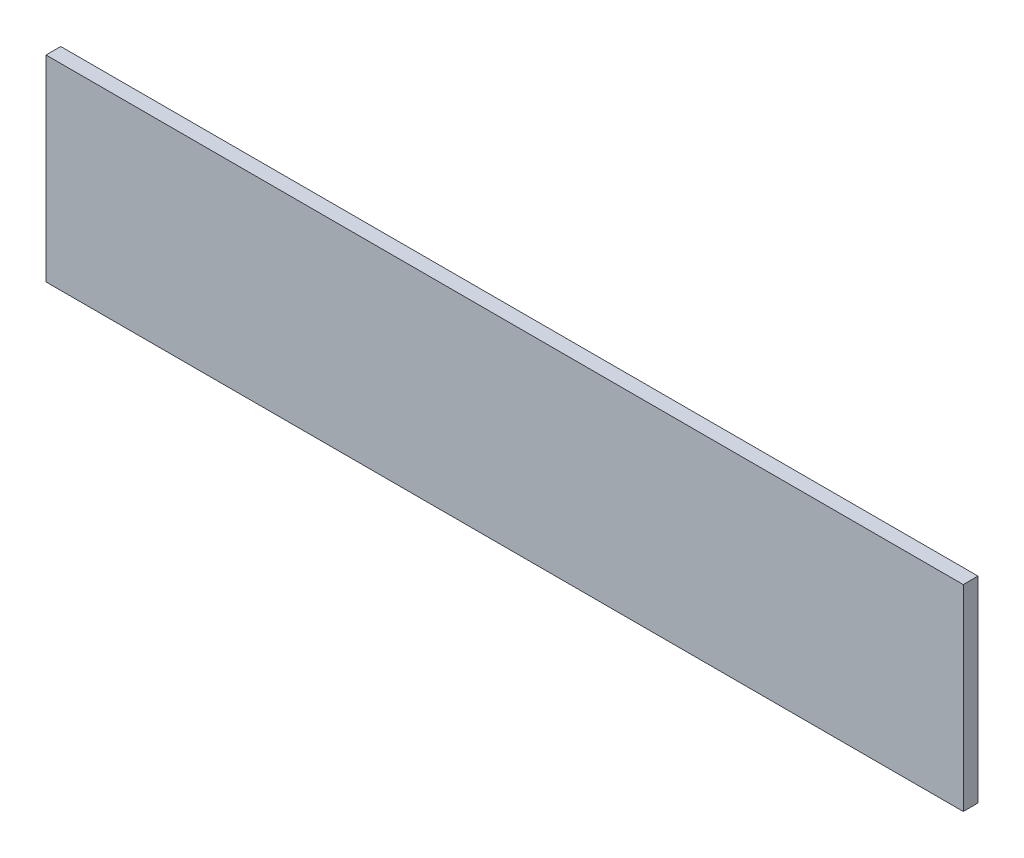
SolidWorks part; units mm, degrees
ref_plane "Front Plane" through (0, 0, 0) normal (0, 0, 1) x (1, 0, 0)
ref_plane "Top Plane" through (0, 0, 0) normal (0, 1, 0) x (1, 0, 0)
ref_plane "Right Plane" through (0, 0, 0) normal (1, 0, 0) x (0, 0, -1)
sketch "Sketch1" plane through (0, 0, 0) normal (0, 0, 1) x (1, 0, 0)
  line L1 (140, -30) -> (-140, -30)
  line L2 (140, -30) -> (140, 30)
  line L3 (140, 30) -> (-140, 30)
  line L4 (-140, -30) -> (-140, 30)
  line L5 (140, -30) -> (-140, 30) construction
  line L6 (140, 30) -> (-140, -30) construction
  point P0 (0, 0)
  dimension "D1" = 280
  dimension "D2" = 60
extrude "Boss-Extrude1" add sketch "Sketch1" along normal blind 4.5
